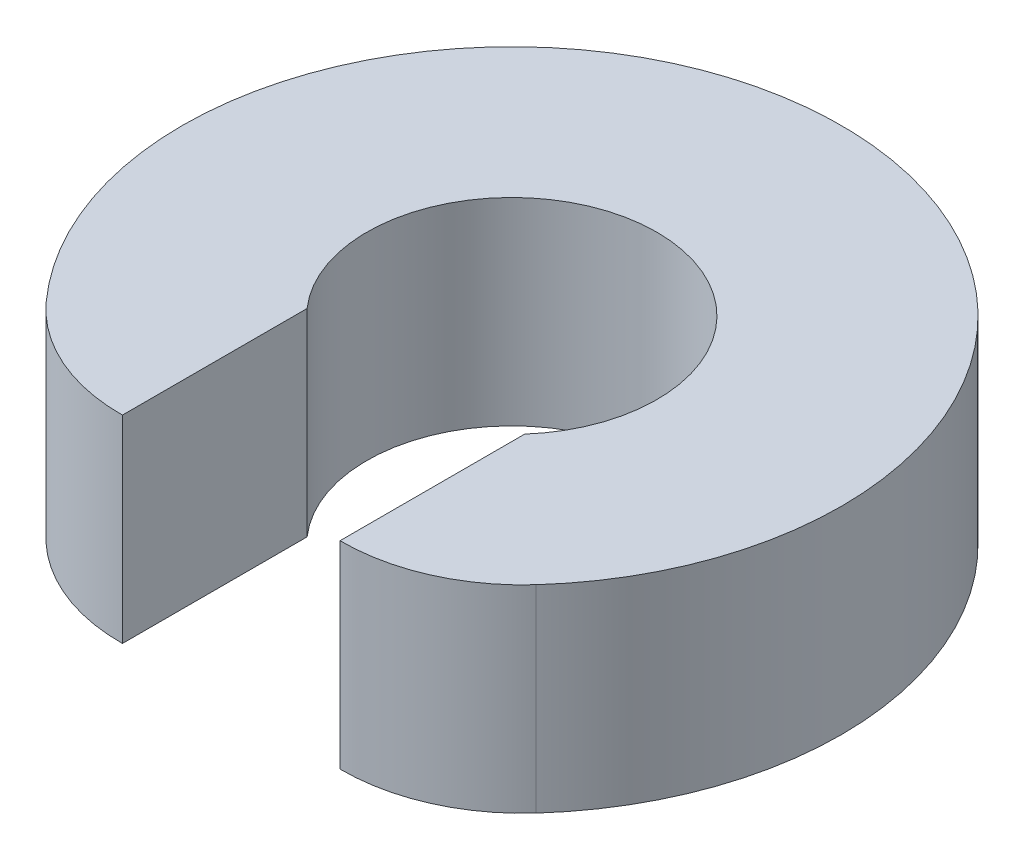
SolidWorks part; units mm, degrees
other "凸台-拉伸1"
ref_plane "前视基准面" through (0, 0, 0) normal (0, 0, 1) x (1, 0, 0)
ref_plane "上视基准面" through (0, 0, 0) normal (0, 1, 0) x (1, 0, 0)
ref_plane "右视基准面" through (0, 0, 0) normal (1, 0, 0) x (0, 0, -1)
imported_body "输入1"
other "移动面1" parameters "D1"=100
